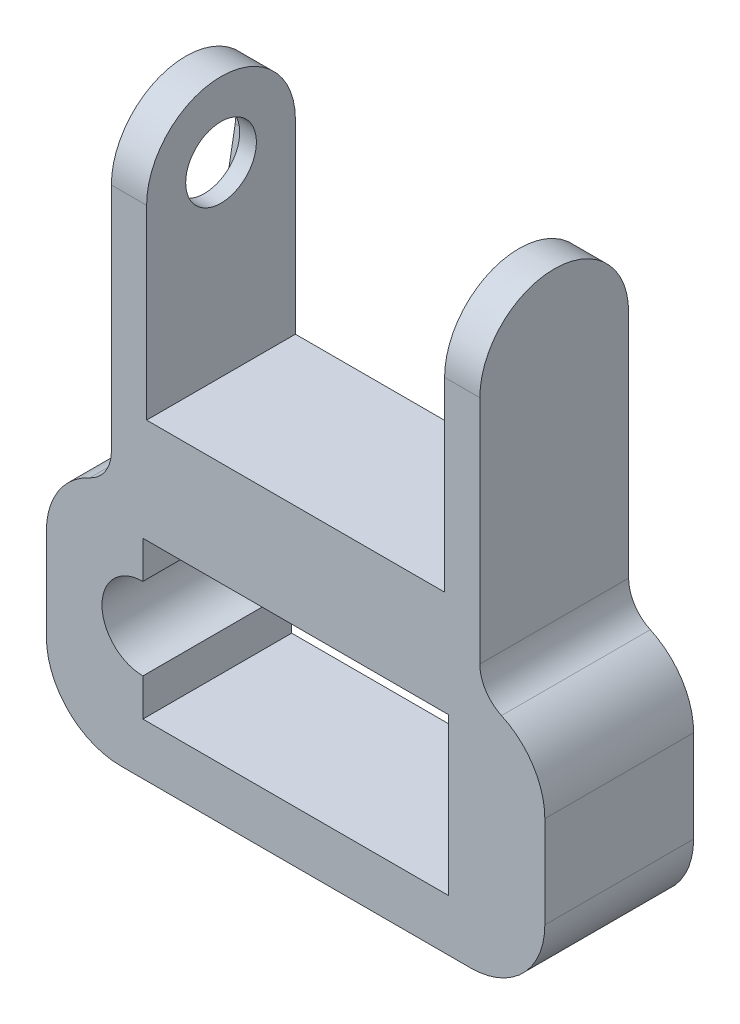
SolidWorks part; units mm, degrees
ref_plane "Front Plane" through (0, 0, 0) normal (0, 0, 1) x (1, 0, 0)
ref_plane "Top Plane" through (0, 0, 0) normal (0, 1, 0) x (1, 0, 0)
ref_plane "Right Plane" through (0, 0, 0) normal (1, 0, 0) x (0, 0, -1)
sketch "Sketch1" plane through (0, 0, 0) normal (0, 0, 1) x (1, 0, 0)
  line L1 (-37.5, -42.5) -> (37.5, -42.5)
  line L2 (-37.5, -42.5) -> (-37.5, 42.5)
  line L3 (-37.5, 42.5) -> (37.5, 42.5)
  line L4 (37.5, -42.5) -> (37.5, 42.5)
  line L5 (-37.5, -42.5) -> (37.5, 42.5) construction
  line L6 (-37.5, 42.5) -> (37.5, -42.5) construction
  point P0 (0, 0)
  dimension "D1" = 85
  dimension "D2" = 75
extrude "Boss-Extrude1" add sketch "Sketch1" along normal blind 20
sketch "Sketch2" plane through (0, 0, 20) normal (0, 0, 1) x (1, 0, 0)
  line L0 (37.5, 42.5) -> (-37.5, 42.5) construction
  line L1 (-20.025, 42.5) -> (20.025, 42.5)
  line L2 (-20.025, 42.5) -> (-20.025, 7.5)
  line L3 (-20.025, 7.5) -> (20.025, 7.5)
  line L4 (20.025, 42.5) -> (20.025, 7.5)
  line L5 (37.5, 42.5) -> (-37.5, 42.5) construction
  point P6 (0, 7.5)
  point P9 (0, 42.5)
  dimension "D1" = 40.05
  dimension "D2" = 35
extrude "Cut-Extrude1" cut sketch "Sketch2" against normal through all
sketch "Sketch3" plane through (0, 0, 20) normal (0, 0, 1) x (1, 0, 0)
  line L0 (-20.025, 7.5) -> (20.025, 7.5) construction
  line L1 (-20.525, -27.55) -> (20.525, -27.55)
  line L2 (-20.525, -27.55) -> (-20.525, -22.525)
  line L3 (-20.525, -6.5) -> (20.525, -6.5)
  line L4 (20.525, -27.55) -> (20.525, -6.5)
  line L5 (-20.525, -11.525) -> (-20.525, -6.5)
  arc A0 (-20.525, -11.525) -> (-20.525, -22.525) centre (-20.525, -17.025) ccw
  point P4 (0, -6.5)
  dimension "D4" = 11
  dimension "D1" = 21.05
  dimension "D2" = 41.05
  dimension "D3" = 14
  dimension "D6" = 11
extrude "Cut-Extrude2" cut sketch "Sketch3" against normal through all
sketch "Sketch4" plane through (0, 0, 20) normal (0, 0, 1) x (1, 0, 0)
  line L0 (-37.5, 42.5) -> (-37.5, -42.5) construction
  line L1 (-37.5, 0) -> (-29.5, 0)
  line L2 (-37.5, 0) -> (-37.5, 42.5)
  line L3 (-37.5, 42.5) -> (-29.5, 42.5)
  line L4 (-29.5, 0) -> (-29.5, 42.5)
  line L5 (0, 42.5) -> (0, -42.5) construction
  line L6 (-37.5, -42.5) -> (37.5, -42.5) construction
  line L7 (37.5, 42.5) -> (29.5, 42.5)
  line L8 (29.5, 0) -> (29.5, 42.5)
  line L9 (37.5, 0) -> (29.5, 0)
  line L10 (37.5, 0) -> (37.5, 42.5)
  dimension "D1" = 8
  dimension "D2" = 42.5
sketch "Sketch5" plane through (-37.5, 0, 0) normal (-1, 0, 0) x (0, 0, 1)
  line L1 (20, 32.5) -> (25, 32.5)
  line L2 (-5, 32.5) -> (0, 32.5)
  line L3 (-5, 32.5) -> (-5, 57.5)
  line L4 (-5, 57.5) -> (25, 57.5)
  line L5 (25, 32.5) -> (25, 57.5)
  line L7 (20, 42.5) -> (0, 42.5) construction
  arc A0 (20, 32.5) -> (0, 32.5) centre (10, 32.5) ccw
  point P4 (10, 42.5)
  dimension "D1" = 10
  dimension "D2" = 5
  dimension "D3" = 25
  dimension "D4" = 30
extrude "Cut-Extrude4" cut sketch "Sketch5" against normal through all
extrude "Cut-Extrude5" cut sketch "Sketch4" against normal through all
sketch "Sketch6" plane through (0, 0, 20) normal (0, 0, 1) x (1, 0, 0)
  line L0 (37.5, -42.5) -> (37.5, 0) construction
  line L1 (-37.5, -42.5) -> (37.5, -42.5)
  line L2 (-37.5, -42.5) -> (-37.5, -34.5)
  line L3 (-37.5, -34.5) -> (37.5, -34.5)
  line L4 (37.5, -42.5) -> (37.5, -34.5)
  dimension "D1" = 8
extrude "Cut-Extrude6" cut sketch "Sketch6" against normal through all
sketch "Sketch8" plane through (-29.5, 0, 0) normal (-1, 0, 0) x (0, 0, 1)
  circle A0 centre (10, 32.5) radius 4.75
  dimension "D1" = 9.5
extrude "Cut-Extrude8" cut sketch "Sketch8" against normal blind 10
sketch "Sketch9" plane through (-29.5, 0, 0) normal (-1, 0, 0) x (0, 0, 1)
  line L1 (15.5, 32.5) -> (14, 10)
  line L2 (4.5, 32.5) -> (6, 10)
  line L3 (0, 0) -> (20, 0) construction
  arc A0 (15.5, 32.5) -> (4.5, 32.5) centre (10, 32.5) ccw
  arc A1 (6, 10) -> (14, 10) centre (10, 10) ccw
  point P7 (10, 0)
  dimension "D1" = 11
  dimension "D2" = 8
  dimension "D3" = 22.5
extrude "Cut-Extrude9" cut sketch "Sketch9" against normal blind 4
sketch "Sketch11" plane through (0, 0, 20) normal (0, 0, 1) x (1, 0, 0)
  line L0 (-24.7625, 42.5) -> (-24.7625, -3.5)
  line L1 (-20.025, 42.5) -> (-29.5, 42.5) construction
  line L2 (-24.7625, -3.5) -> (-33.5, -3.5)
  line L3 (-33.5, -3.5) -> (-33.5, -34.5)
  line L4 (37.5, -34.5) -> (-37.5, -34.5) construction
  line L6 (-37.5, 0) -> (-29.5, 0) construction
  line L7 (-33.5, -34.5) -> (-37.5, -34.5)
  line L8 (-37.5, -34.5) -> (-37.5, 0)
  line L9 (-37.5, 0) -> (-29.5, 0)
  line L10 (-29.5, 0) -> (-29.5, 42.5)
  line L11 (-29.5, 42.5) -> (-24.7625, 42.5)
  line L12 (0, 42.5) -> (0, -34.5) construction
  line L13 (29.5, 0) -> (29.5, 42.5)
  line L14 (37.5, 0) -> (29.5, 0)
  line L15 (37.5, -34.5) -> (37.5, 0)
  line L16 (33.5, -34.5) -> (37.5, -34.5)
  line L17 (33.5, -3.5) -> (33.5, -34.5)
  line L18 (24.7625, -3.5) -> (33.5, -3.5)
  line L19 (24.7625, 42.5) -> (24.7625, -3.5)
  line L20 (29.5, 42.5) -> (24.7625, 42.5)
  point P10 (-33.5, 0)
  dimension "D1" = 46
extrude "Cut-Extrude11" cut sketch "Sketch11" against normal through all
sketch "Sketch12" plane through (-24.7625, 0, 0) normal (-1, 0, 0) x (0, 0, 1)
  line L0 (3.3559, 31.3088) -> (6.3089, 14.8382)
  line L1 (10, 32.5) -> (10, 15.5) construction
  line L2 (16.75, 32.5) -> (13.695, 14.8601)
  arc A0 (16.75, 32.5) -> (3.3559, 31.3088) centre (10, 32.5) ccw
  arc A1 (6.3089, 14.8382) -> (13.695, 14.8601) centre (10, 15.5) ccw
  dimension "D1" = 13.5
  dimension "D2" = 7.5
  dimension "D3" = 17
extrude "Cut-Extrude12" cut sketch "Sketch12" against normal blind 2.5
fillet "Fillet1" radius 5 2 edges at (24.7625, -3.5, 10) (-24.7625, -3.5, 10)
fillet "Fillet2" radius 10 2 edges at (33.5, -3.5, 10) (-33.5, -3.5, 10)
fillet "Fillet3" radius 10 2 edges at (33.5, -34.5, 10) (-33.5, -34.5, 10)
